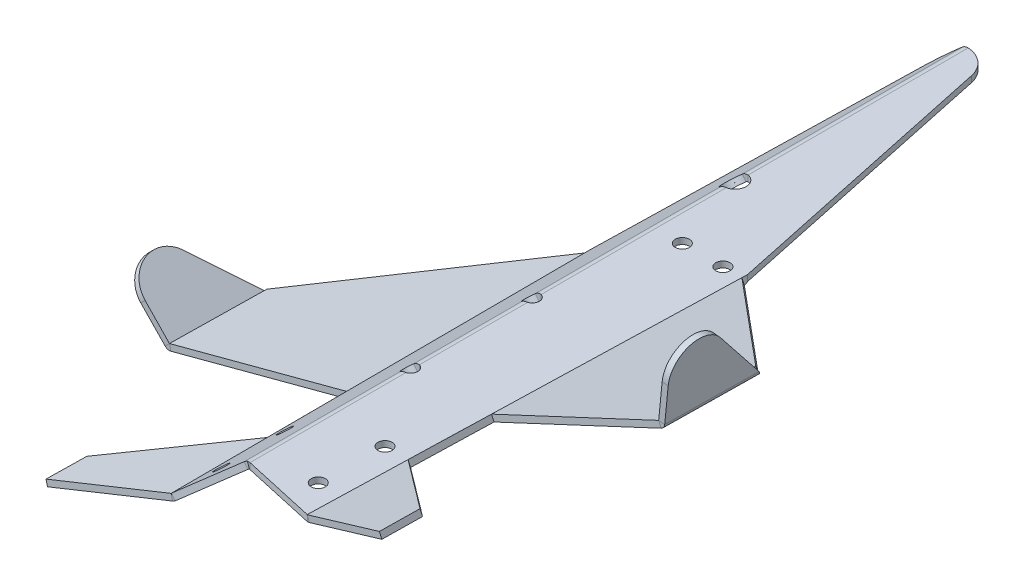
SolidWorks part; units mm, degrees
ref_plane "Front Plane" through (0, 0, 0) normal (0, 0, 1) x (1, 0, 0)
ref_plane "Top Plane" through (0, 0, 0) normal (0, 1, 0) x (1, 0, 0)
ref_plane "Right Plane" through (0, 0, 0) normal (1, 0, 0) x (0, 0, -1)
sketch "Sketch1" plane through (0, 0, 0) normal (0, 1, 0) x (1, 0, 0)
  line L0 (0, 0) -> (0, 170) construction
  line L1 (0, 0) -> (-45, -10)
  line L2 (-45, -10) -> (-45, 0)
  line L3 (-45, 0) -> (-19.6972, 20)
  line L4 (-19.6972, 20) -> (-20.2729, 40)
  line L5 (-20.2729, 40) -> (-75, 40)
  line L6 (-22, 100) -> (-79.4659, 52.3904)
  line L7 (-22, 100) -> (-6.8477, 171.4521)
  line L8 (-19.6972, 20) -> (-19, -4.2222) construction
  line L9 (-20.2729, 40) -> (-22, 100) construction
  line L10 (0, 170) -> (0, 177) construction
  line L11 (-19.6972, 20) -> (0, 20) construction
  line L12 (-19.2367, 4) -> (0, 4) construction
  line L13 (-13.6947, 20) -> (-13.2342, 4) construction
  line L14 (-13.6997, 20.1726) -> (-13.0025, -4.0496) construction
  line L15 (-20.2729, 40) -> (0, 40) construction
  line L16 (0, 0) -> (45, -10)
  line L17 (45, -10) -> (45, 0)
  line L18 (45, 0) -> (19.6972, 20)
  line L19 (19.6972, 20) -> (20.2729, 40)
  line L20 (20.2729, 40) -> (75, 40)
  line L21 (22, 100) -> (79.4659, 52.3904)
  line L22 (22, 100) -> (6.8477, 171.4521)
  line L23 (-22, 100) -> (22, 100) construction
  arc A0 (6.8477, 171.4521) -> (-6.8477, 171.4521) centre (0, 170) ccw
  arc A1 (-79.4659, 52.3904) -> (-75, 40) centre (-75, 47) ccw
  circle A2 centre (-13.6947, 20) radius 1.75
  circle A3 centre (-13.2342, 4) radius 1.75
  circle A4 centre (0, 120) radius 2.75
  circle A5 centre (0, 70) radius 1.75
  circle A6 centre (0, 40) radius 1.75
  circle A7 centre (13.6947, 20) radius 1.75
  circle A8 centre (13.2342, 4) radius 1.75
  arc A9 (79.4659, 52.3904) -> (75, 40) centre (75, 47) cw
  circle A10 centre (7, 100) radius 1.75
  circle A11 centre (17, 100) radius 1.75
  dimension "D2" = 14
  dimension "D9" = 7
  dimension "D16" = 3.5
  dimension "D17" = 5.5
  dimension "D18" = 20
  dimension "D19" = 30
  dimension "D20" = 7
  dimension "D21" = 10
  dimension "D3" = 19
  dimension "D4" = 45
  dimension "D5" = 22
  dimension "D6" = 10
  dimension "D7" = 20
  dimension "D8" = 20
  dimension "D10" = 60
  dimension "D11" = 10
  dimension "D12" = 30
  dimension "D13" = 170
  dimension "D14" = 14
  dimension "D15" = 6
sheet metal parameters "Sheet-Metal1" thickness 1.5 parameters "D1"=0.7366
base flange "Base-Flange1" sketch "Sketch1" thickness 1.5 reverse thickness direction yes parameters "D1"=0.7366
sketch "Sketch3" plane through (0, 1.5, 0) normal (0, 1, 0) x (1, 0, 0)
  line L0 (-66, 63.5466) -> (-66, 40)
  line L1 (-22, 100) -> (-79.4659, 52.3904) construction
  line L2 (-75, 40) -> (-20.2729, 40) construction
  line L3 (66, 63.5466) -> (66, 40)
  line L4 (79.4659, 52.3904) -> (22, 100) construction
  line L5 (20.2729, 40) -> (75, 40) construction
  dimension "D1" = 66
  dimension "D2" = 66
sketched bend "Sketched Bend1" parameters "D1"=0
bend "SketchBend1" bend radius 0 bend angle 60 parameters "D5"=1
bend "SketchBend2" bend radius 0 bend angle 60 parameters "D5"=2
sketch "Sketch4" plane through (0, 1.5, 0) normal (0, 1, 0) x (1, 0, 0)
  line L0 (-20.2729, 40) -> (-22, 100)
  line L1 (20.2729, 40) -> (22, 100)
sketched bend "Sketched Bend4" parameters "D1"=0
bend "SketchBend7" bend radius 0 bend angle 25 parameters "D5"=3
bend "SketchBend8" bend radius 0 bend angle 25 parameters "D5"=4
sketch "Sketch5" plane through (0, 1.5, 0) normal (0, 1, 0) x (1, 0, 0)
  line L0 (0, 0) -> (0, 177)
  arc A0 (6.8477, 171.4521) -> (-6.8477, 171.4521) centre (0, 170) ccw construction
sketched bend "Sketched Bend7" parameters "D1"=0.7366
bend "SketchBend9" bend radius 0.7366 bend angle 40 parameters "D5"=5
sketch "Sketch8" plane through (0, 0, 0) normal (0, 1, 0) x (1, 0, 0)
  line L0 (0, 0) -> (0, 285.8547)
ref_plane "Plane2" through (0, 0, 0) normal (-0.342, 0.9397, 0) x (0, 0, -1)
sketch "Sketch9" plane through (0, 0, 0) normal (-0.342, 0.9397, 0) x (0, 0, -1)
  line L0 (0, -0.2357) -> (190.9466, -0.2357) construction
  circle A0 centre (40, -0.2357) radius 0.005
  circle A1 centre (70, -0.2357) radius 0.005
  circle A2 centre (120, -0.2357) radius 0.005
  dimension "D2" = 30
  dimension "D3" = 50
  dimension "D4" = 0.01
  dimension "D1" = 40
extrude "Boss-Extrude1" add sketch "Sketch9" along normal blind 1 separate body
flat pattern "Flat-Pattern1"
sketch "Bend-Lines1" plane through (0, 0, 0) normal (0, 1, 0) x (-1, 0, 0)
bend of the flat pattern "Flatten-<SketchBend1>1"
bend of the flat pattern "Flatten-<SketchBend2>1"
bend of the flat pattern "Flatten-<SketchBend7>1"
bend of the flat pattern "Flatten-<SketchBend8>1"
bend of the flat pattern "Flatten-<SketchBend9>1"
